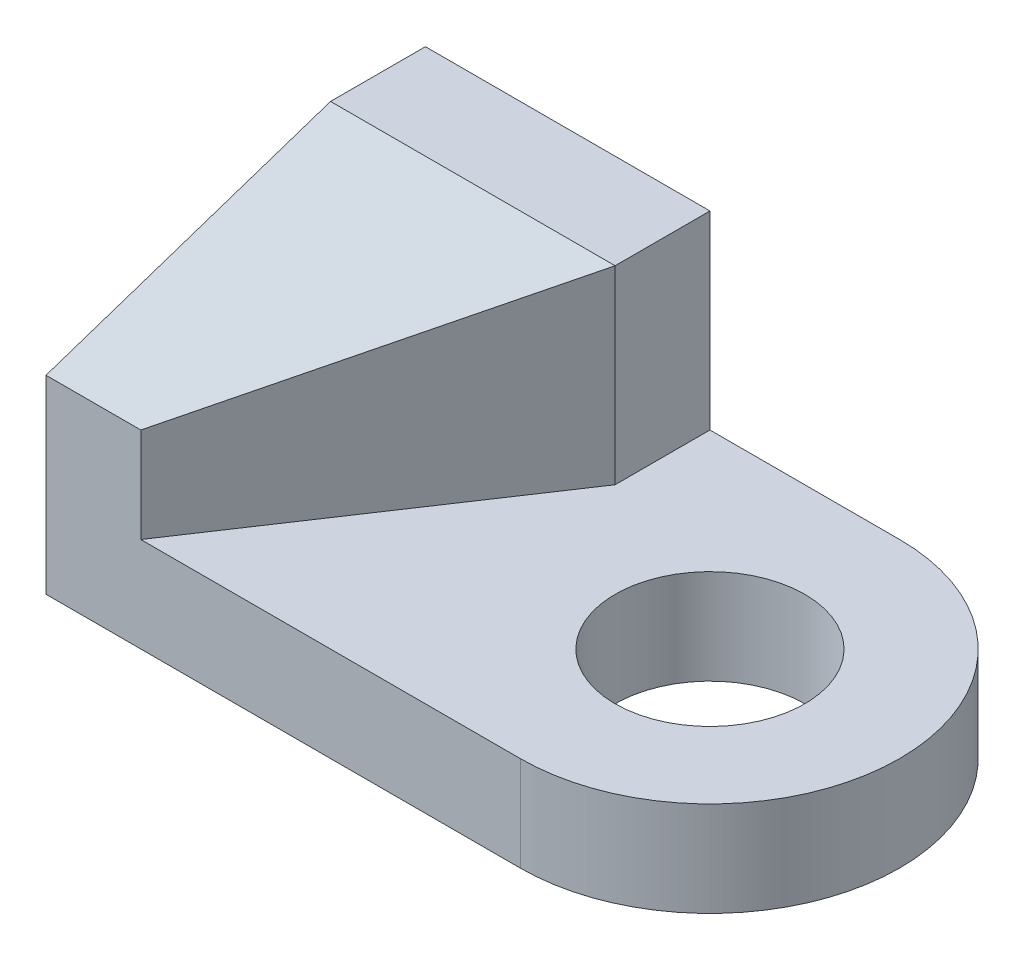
SolidWorks part; units mm, degrees
ref_plane "Front Plane" through (0, 0, 0) normal (0, 0, 1) x (1, 0, 0)
ref_plane "Top Plane" through (0, 0, 0) normal (0, 1, 0) x (1, 0, 0)
ref_plane "Right Plane" through (0, 0, 0) normal (1, 0, 0) x (0, 0, -1)
sketch "Sketch1" plane through (0, 0, 0) normal (0, 1, 0) x (1, 0, 0)
  line L0 (0, 20) -> (-50, 20)
  line L1 (-50, 20) -> (-50, -20)
  line L2 (-50, -20) -> (0, -20)
  arc A0 (0, -20) -> (0, 20) centre (0, 0) ccw
  dimension "D1" = 40
  dimension "D2" = 50
extrude "Extrude1" add sketch "Sketch1" along normal blind 10
sketch "Sketch2" plane through (0, 10, 0) normal (0, 1, 0) x (1, 0, 0)
  circle A0 centre (0, 0) radius 10
  dimension "D1" = 20
extrude "Extrude2" cut sketch "Sketch2" against normal blind 10
sketch "Sketch3" plane through (0, 0, -20) normal (0, 0, -1) x (-1, 0, 0)
  line L1 (50, 10) -> (20, 10)
  line L2 (50, 10) -> (50, 30)
  line L4 (50, 30) -> (20, 30)
  line L5 (20, 10) -> (20, 30)
  dimension "D1" = 30
  dimension "D2" = 20
extrude "Extrude3" add sketch "Sketch3" against normal through all
chamfer "Chamfer1" distance 20 distance2 30 1 edges
chamfer "Chamfer2" distance 10 distance2 30 1 edges at (-45, 30, 20)
